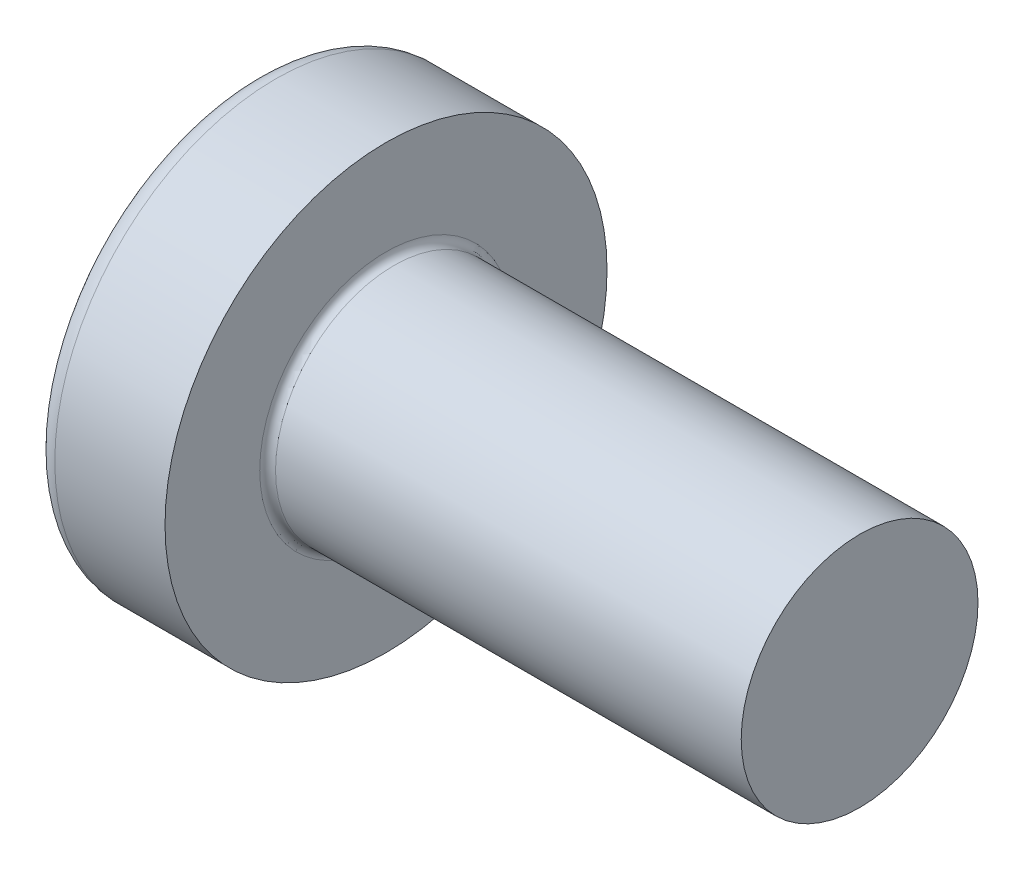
SolidWorks part; units mm, degrees
ref_plane "Plane1" through (0, 0, 0) normal (0, 0, 1) x (1, 0, 0)
ref_plane "Plane2" through (0, 0, 0) normal (0, 1, 0) x (1, 0, 0)
ref_plane "Plane3" through (0, 0, 0) normal (1, 0, 0) x (0, 0, -1)
sketch "BodySke" plane through (0, 0, 0) normal (0, 0, 1) x (1, 0, 0)
  line L0 (2.4, 1.5) -> (2.4, 2.8)
  line L1 (2.65, 6.35) -> (2.65, -3.175) construction
  line L2 (-25.4, 0) -> (127, 0) construction
  line L3 (8.4, 0) -> (0, 0)
  line L4 (2.4, 1.5) -> (8.4, 1.5)
  line L5 (8.4, 1.5) -> (8.4, 0)
  line L6 (1.0035, 2.8) -> (2.4, 2.8)
  line L8 (2.4, 6.35) -> (2.4, -3.175) construction
  arc A0 (0.7754, 2.6744) -> (0, 0) centre (5, 0) ccw
  arc A2 (0.7754, 2.6744) -> (1.0035, 2.8) centre (1.0035, 2.53) cw
revolve "Base-Revolve" add sketch "BodySke"
fillet "Fillet1" radius 0.1 1 edges at (2.4, 0, 1.5)
sketch "Sketch3" plane through (0, 0, 0) normal (1, 0, 0) x (0, 0, -1)
  line L0 (0.37, -1.4) -> (-0.37, -1.4)
  line L1 (0.37, -1.4) -> (0.37, 1.4)
  line L2 (-0.37, 1.4) -> (0.37, 1.4)
  line L3 (-0.37, 1.4) -> (-0.37, -1.4)
ref_plane "Plane4" through (1.75, 0, 0) normal (1, 0, 0) x (0, 0, -1)
sketch "Sketch4" plane through (1.75, 0, 0) normal (1, 0, 0) x (0, 0, -1)
  line L0 (0.37, -0.5275) -> (-0.37, -0.5275)
  line L1 (0.37, -0.5275) -> (0.37, 0.5275)
  line L2 (-0.37, 0.5275) -> (0.37, 0.5275)
  line L3 (-0.37, 0.5275) -> (-0.37, -0.5275)
loft "Recess" cut profiles "Sketch3", "Sketch4"
pattern_circular "RecPat" count 2 every 90 about axis through (0, 0, 0) along (1, 0, 0) of "Recess"
sketch "RecCorSke" plane through (0, 0, 0) normal (0, 0, 1) x (1, 0, 0)
  line L0 (-3.175, 0) -> (15.875, 0) construction
  line L1 (-25.4, 0) -> (127, 0) construction
  line L2 (0, 0) -> (0, 0.6784)
  line L3 (0, 0.6784) -> (1.75, 0.556)
  line L4 (1.75, 0.556) -> (1.9307, 0)
  line L5 (1.9307, 0) -> (0, 0)
revolve "RecessCore" cut sketch "RecCorSke" angle 360 about L0
sketch "ThdSchSke" plane through (0, 0, 0) normal (0, 0, 1) x (1, 0, 0)
  line L0 (3.4, -1.2195) -> (3.2036, -1.5)
  line L1 (3.4, -1.2195) -> (3.5964, -1.5)
  line L2 (3.5964, -1.5) -> (3.5964, -1.875)
  line L3 (-3.175, 0) -> (5.1513, 0) construction
  line L5 (3.5964, -1.875) -> (3.2036, -1.875)
  line L6 (3.2036, -1.875) -> (3.2036, -1.5)
revolve "ThreadSchematic" [suppressed] cut sketch "ThdSchSke" angle 360 about L3
pattern_linear "ThdSchPat" [suppressed]
equation "\"D1@Sketch3\" = \"Cross_dia@Sketch3\" / 2"
equation "\"D2@Sketch3\" = \"Cross_width@Sketch3\" / 2"
equation "\"Depth@RecCorSke\" = \"Cross_depth@Plane4\""
equation "\"D1@Sketch4\" = \"Cross_width@Sketch3\""
equation "\"D2@Sketch4\" = \"Cross_dia@Sketch3\" - 2.0 * \"Cross_depth@Plane4\" * tan(26.5  * 0.017453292)"
equation "\"D3@Sketch4\" = \"D1@Sketch4\" / 2"
equation "\"D4@Sketch4\" = \"D2@Sketch4\" / 2"
equation "\"Thread_length@ThreadCosmetic\" = ((sgn( (\"Length@BodySke\" - \"Advance@BodySke\" * 2.0 ) - \"Thread_nom@BodySke\" )-1)*( (\"Length@BodySke\" - \"Advance@BodySke\" * 2.0 ) - \"Thread_nom@BodySke\" ))/-2+ \"Thread_"
equation "\"Thread_minor@ThdSchSke\" = \"Thread_minor@ThreadCosmetic\""
equation "\"Diameter@ThdSchSke\" = \"Diameter@BodySke\""
equation "\"Overcut@ThdSchSke\" = \"Diameter@BodySke\" * 1.25"
equation "\"Start@ThdSchSke\" = \"Head_ht@BodySke\" + \"Length@BodySke\" - \"Thread_length@ThreadCosmetic\"  '---Non-countersunk---"
equation "\"Num_threads@ThdSchPat\" = int( \"Thread_length@ThreadCosmetic\" / \"Advance@BodySke\" + 0.999 )  + 1"
equation "\"Advance@ThdSchPat\" = \"Thread_length@ThreadCosmetic\" /  (\"Num_threads@ThdSchPat\" - 1) 'relax it"
